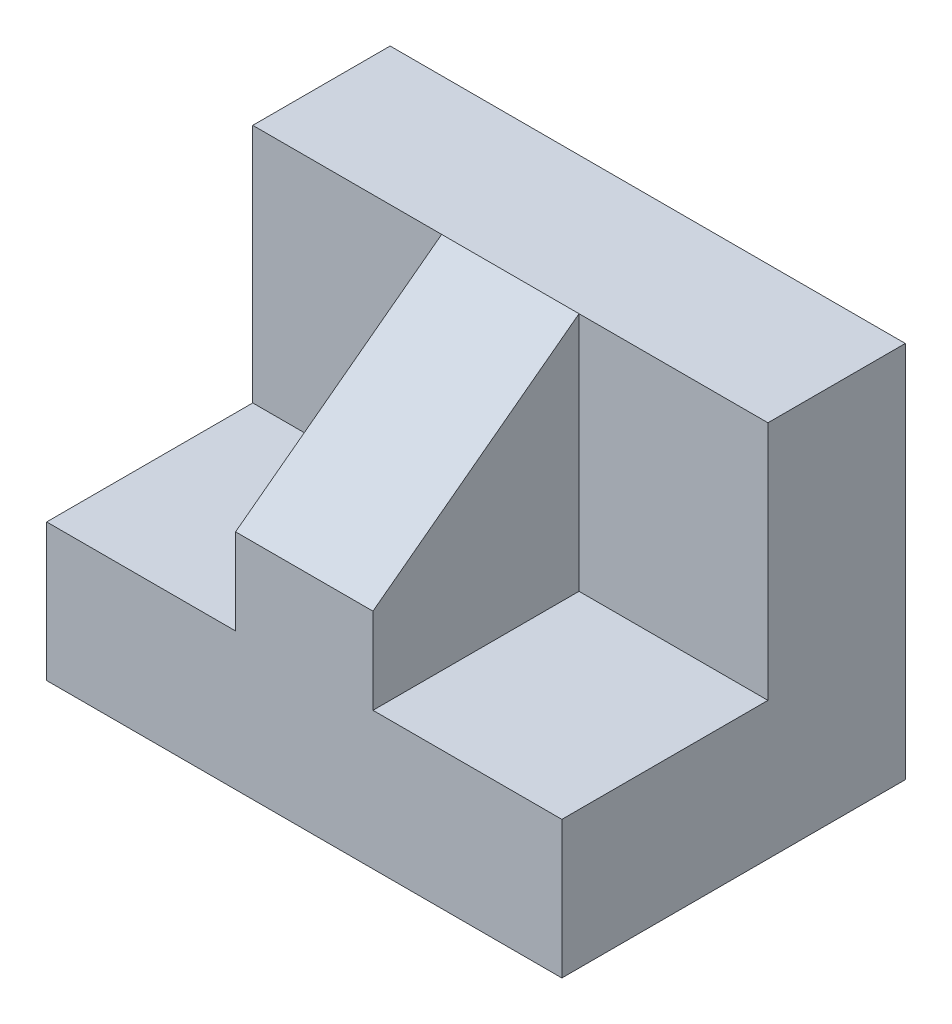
SolidWorks part; units mm, degrees
ref_plane "前视基准面" through (0, 0, 0) normal (0, 0, 1) x (1, 0, 0)
ref_plane "上视基准面" through (0, 0, 0) normal (0, 1, 0) x (1, 0, 0)
ref_plane "右视基准面" through (0, 0, 0) normal (1, 0, 0) x (0, 0, -1)
sketch "草图1" plane through (0, 0, 0) normal (0, 1, 0) x (1, 0, 0)
  line L1 (0, 0) -> (30, 0)
  line L2 (0, 0) -> (0, 20)
  line L3 (0, 20) -> (30, 20)
  line L4 (30, 0) -> (30, 20)
  dimension "D1" = 30
  dimension "D2" = 20
extrude "拉伸1" add sketch "草图1" along normal blind 8
sketch "草图2" plane through (0, 8, 0) normal (0, 1, 0) x (1, 0, 0)
  line L0 (30, 0) -> (30, 20) construction
  line L1 (0, 20) -> (30, 20)
  line L2 (0, 20) -> (0, 12)
  line L3 (0, 12) -> (30, 12)
  line L4 (30, 20) -> (30, 12)
  dimension "D1" = 8
extrude "拉伸2" add sketch "草图2" along normal blind 14
ref_plane "基准面1" through (11, 0, 0) normal (1, 0, 0) x (0, 0, -1)
sketch "草图3" plane through (11, 0, 0) normal (1, 0, 0) x (0, 0, -1)
  line L0 (12, 22) -> (0, 13)
  line L1 (0, 13) -> (0, 8)
  line L2 (0, 8) -> (12, 8)
  line L3 (12, 8) -> (12, 22)
  dimension "D1" = 5
extrude "拉伸3" add sketch "草图3" along normal blind 8
